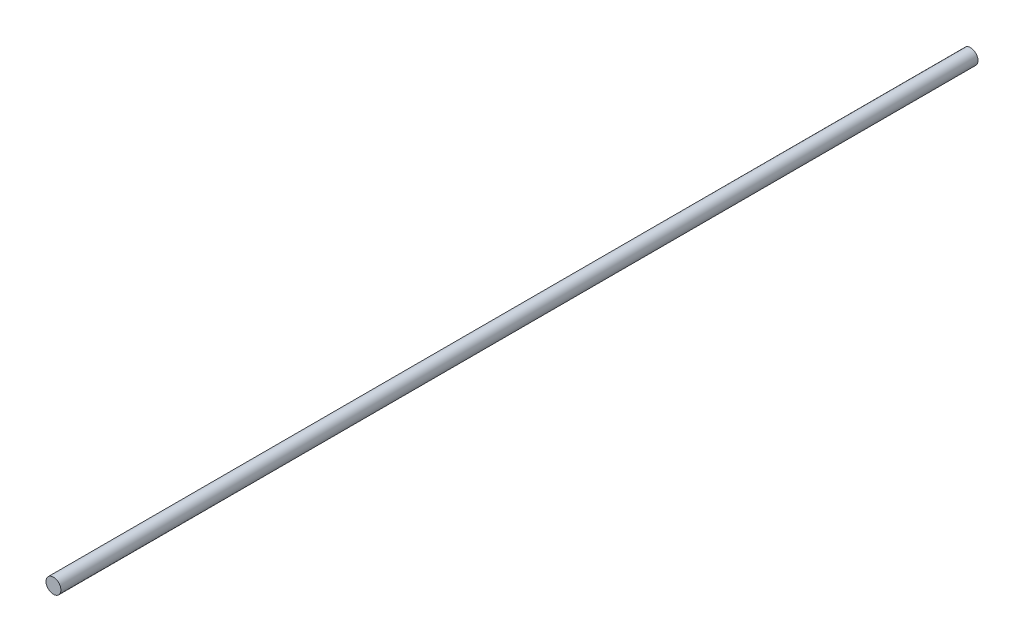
SolidWorks part; units mm, degrees
ref_plane "Ebene vorne" through (0, 0, 0) normal (0, 0, 1) x (1, 0, 0)
ref_plane "Ebene oben" through (0, 0, 0) normal (0, 1, 0) x (1, 0, 0)
ref_plane "Ebene rechts" through (0, 0, 0) normal (1, 0, 0) x (0, 0, -1)
sketch "Skizze1" plane through (0, 0, 0) normal (0, 0, 1) x (1, 0, 0)
  circle A0 centre (0, 0) radius 5
  dimension "D1" = 10
extrude "Aufsatz-Linear austragen1" add sketch "Skizze1" along normal blind 615
